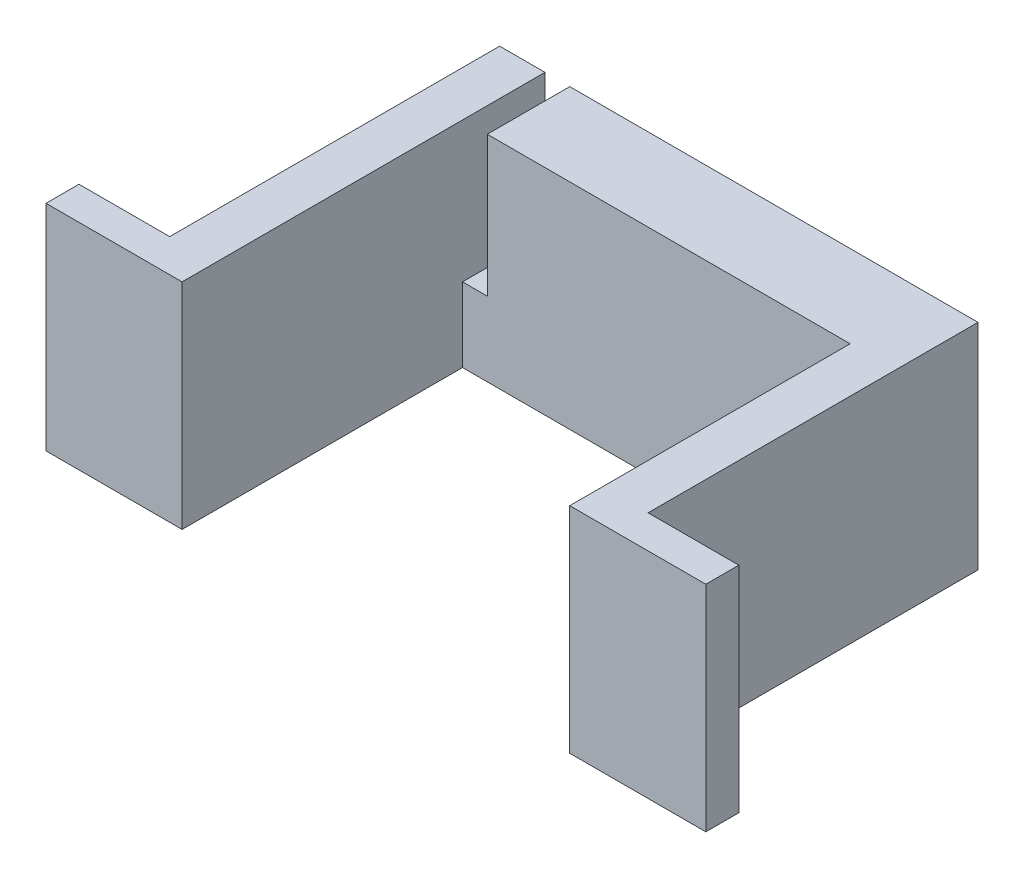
SolidWorks part; units mm, degrees
ref_plane "Спереди" through (0, 0, 0) normal (0, 0, 1) x (1, 0, 0)
ref_plane "Сверху" through (0, 0, 0) normal (0, 1, 0) x (1, 0, 0)
ref_plane "Справа" through (0, 0, 0) normal (1, 0, 0) x (0, 0, -1)
sketch "Эскиз1" plane through (0, 0, 0) normal (0, 1, 0) x (1, 0, 0)
  line L1 (0, 0) -> (29, 0)
  line L2 (0, 0) -> (0, 22)
  line L3 (0, 22) -> (29, 22)
  line L4 (29, 0) -> (29, 22)
  dimension "D1" = 29
  dimension "D2" = 22
extrude "Бобышка-Вытянуть1" add sketch "Эскиз1" along normal blind 13
sketch "Эскиз2" plane through (29, 0, 0) normal (1, 0, 0) x (0, 0, -1)
  line L0 (0, 0) -> (22, 0) construction
  line L1 (0, 13) -> (2, 13)
  line L2 (0, 13) -> (0, 0)
  line L3 (0, 0) -> (2, 0)
  line L4 (2, 13) -> (2, 0)
  dimension "D1" = 2
extrude "Бобышка-Вытянуть2" add sketch "Эскиз2" along normal blind 5.5
sketch "Эскиз3" plane through (0, 0, 0) normal (-1, 0, 0) x (0, 0, 1)
  line L0 (-22, 13) -> (0, 13) construction
  line L1 (0, 0) -> (-2, 0)
  line L2 (0, 0) -> (0, 13)
  line L3 (0, 13) -> (-2, 13)
  line L4 (-2, 0) -> (-2, 13)
  dimension "D1" = 2
extrude "Бобышка-Вытянуть3" add sketch "Эскиз3" along normal blind 5.5
sketch "Эскиз4" plane through (0, 13, 0) normal (0, 1, 0) x (1, 0, 0)
  line L0 (14.5, 22) -> (14.5, -1.1822) construction
  line L1 (29, 22) -> (0, 22) construction
  line L2 (-5.5, 0) -> (34.5, 0) construction
  line L3 (2.75, 0) -> (26.25, 0)
  line L4 (2.75, 0) -> (2.75, 17)
  line L5 (2.75, 17) -> (26.25, 17)
  line L6 (26.25, 0) -> (26.25, 17)
  dimension "D1" = 11.75
  dimension "D2" = 23.5
  dimension "D3" = 17
extrude "Вырез-Вытянуть1" cut sketch "Эскиз4" against normal through all
sketch "Эскиз5" plane through (0, 0, -17) normal (0, 0, 1) x (1, 0, 0)
  line L0 (2.75, 0) -> (26.25, 0) construction
  line L1 (2.75, 13) -> (4.25, 13)
  line L2 (2.75, 13) -> (2.75, 4.5)
  line L3 (2.75, 4.5) -> (4.25, 4.5)
  line L4 (4.25, 13) -> (4.25, 4.5)
  dimension "D1" = 1.5
  dimension "D2" = 4.5
extrude "Вырез-Вытянуть2" cut sketch "Эскиз5" against normal through all
